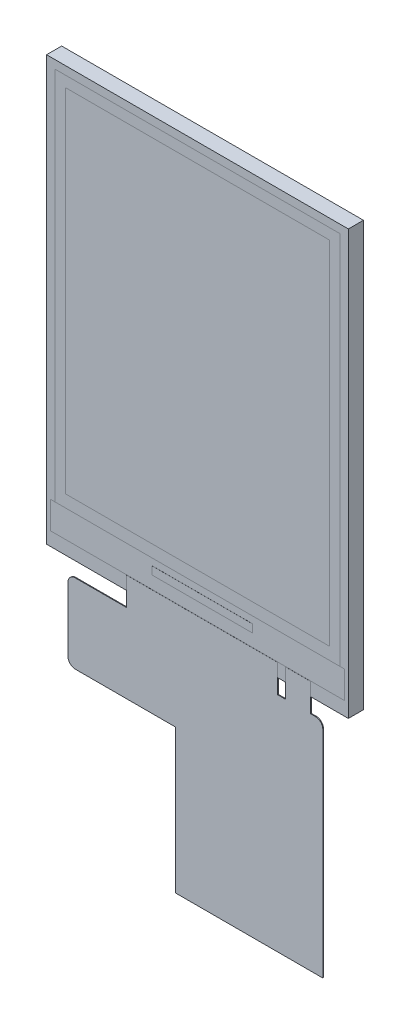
SolidWorks part; units mm, degrees
ref_plane "Front Plane" through (0, 0, 0) normal (0, 0, 1) x (1, 0, 0)
ref_plane "Top Plane" through (0, 0, 0) normal (0, 1, 0) x (1, 0, 0)
ref_plane "Right Plane" through (0, 0, 0) normal (1, 0, 0) x (0, 0, -1)
sketch "Sketch1" plane through (0, 0, 0) normal (0, 0, 1) x (1, 0, 0)
  line L1 (-21, 29.5) -> (21, 29.5)
  line L2 (-21, 29.5) -> (-21, -29.5)
  line L3 (-21, -29.5) -> (21, -29.5)
  line L4 (21, 29.5) -> (21, -29.5)
  line L5 (-19.86, 28.35) -> (19.86, 28.35)
  line L6 (-19.86, 28.35) -> (-19.86, -23.81)
  line L7 (-19.86, -23.81) -> (19.86, -23.81)
  line L8 (19.86, 28.35) -> (19.86, -23.81)
  line L9 (-20.43, -23.81) -> (20.43, -23.81)
  line L10 (-20.43, -23.81) -> (-20.43, -27.61)
  line L11 (-20.43, -27.61) -> (20.43, -27.61)
  line L12 (20.43, -23.81) -> (20.43, -27.61)
  line L13 (-18.36, 26.85) -> (18.36, 26.85)
  line L14 (-18.36, 26.85) -> (-18.36, -22.11)
  line L15 (-18.36, -22.11) -> (18.36, -22.11)
  line L16 (18.36, 26.85) -> (18.36, -22.11)
  point P8 (0, 29.5)
  point P10 (-21, 0)
  dimension "D1" = 42
  dimension "D2" = 59
  dimension "D3" = 1.15
  dimension "D4" = 1.14
  dimension "D5" = 52.16
  dimension "D6" = 39.72
  dimension "D7" = 55.96
  dimension "D8" = 36.72
  dimension "D9" = 48.96
  dimension "D10" = 2.65
  dimension "D11" = 2.64
  dimension "D12" = 0.57
  dimension "D13" = 0.57
sketch "Sketch2" plane through (0, 0, 0) normal (0, 0, 1) x (1, 0, 0)
  line L1 (-9.8446, -27.65) -> (11.1554, -27.65)
  line L2 (-18, -32.55) -> (-18, -41.55)
  line L3 (-17, -42.55) -> (17.45, -42.55)
  line L4 (17.45, -32.55) -> (17.45, -42.55)
  line L5 (21, 29.5) -> (21, -29.5) construction
  line L6 (-3.05, -42.55) -> (17.45, -42.55)
  line L7 (-3.05, -42.55) -> (-3.05, -62.55)
  line L8 (-3.05, -62.55) -> (17.45, -62.55)
  line L9 (17.45, -42.55) -> (17.45, -62.55)
  line L10 (-17, -31.55) -> (-9.8446, -31.55)
  line L11 (-9.8446, -31.55) -> (-9.8446, -27.65)
  line L12 (15.75, -27.65) -> (15.75, -31.55)
  line L13 (15.75, -31.55) -> (16.45, -31.55)
  line L14 (11.1554, -27.65) -> (11.1554, -31.55)
  line L15 (11.1554, -31.55) -> (12.25, -31.55)
  line L16 (12.25, -31.55) -> (12.25, -27.65)
  line L17 (12.25, -27.65) -> (15.75, -27.65)
  arc A0 (-18, -41.55) -> (-17, -42.55) centre (-17, -41.55) ccw
  arc A1 (17.45, -32.55) -> (16.45, -31.55) centre (16.45, -32.55) ccw
  arc A2 (-17, -31.55) -> (-18, -32.55) centre (-17, -32.55) ccw
extrude "Boss-Extrude1" add sketch "Sketch1" along normal blind 2.1 contours L2 L3 L4 L1
extrude "Boss-Extrude3" add sketch "Sketch2" along normal blind 0.1 from offset 2.01 separate body contours L17 L16 L15 L14 L1 L11 L10 L2 L3 L4 L13 L12 | L9 L3 L7 L8
sketch "Sketch4" plane through (0, 0, 2.01) normal (0, 0, -1) x (-1, 0, 0)
  line L0 (3.05, -62.55) -> (-17.45, -62.55) construction
  line L1 (-17.125, -59.05) -> (-16.775, -59.05)
  line L2 (-17.125, -59.05) -> (-17.125, -62.55)
  line L3 (-17.125, -62.55) -> (-16.775, -62.55)
  line L4 (-16.775, -59.05) -> (-16.775, -62.55)
  line L6 (-16.625, -59.05) -> (-16.625, -62.55)
  line L7 (-16.625, -59.05) -> (-16.275, -59.05)
  line L8 (-16.275, -59.05) -> (-16.275, -62.55)
  line L9 (-16.625, -62.55) -> (-16.275, -62.55)
  line L10 (-16.125, -59.05) -> (-16.125, -62.55)
  line L11 (-16.125, -59.05) -> (-15.775, -59.05)
  line L12 (-15.775, -59.05) -> (-15.775, -62.55)
  line L13 (-16.125, -62.55) -> (-15.775, -62.55)
  line L14 (-15.625, -59.05) -> (-15.625, -62.55)
  line L15 (-15.625, -59.05) -> (-15.275, -59.05)
  line L16 (-15.275, -59.05) -> (-15.275, -62.55)
  line L17 (-15.625, -62.55) -> (-15.275, -62.55)
  line L18 (-15.125, -59.05) -> (-15.125, -62.55)
  line L19 (-15.125, -59.05) -> (-14.775, -59.05)
  line L20 (-14.775, -59.05) -> (-14.775, -62.55)
  line L21 (-15.125, -62.55) -> (-14.775, -62.55)
  line L22 (-14.625, -59.05) -> (-14.625, -62.55)
  line L23 (-14.625, -59.05) -> (-14.275, -59.05)
  line L24 (-14.275, -59.05) -> (-14.275, -62.55)
  line L25 (-14.625, -62.55) -> (-14.275, -62.55)
  line L26 (-14.125, -59.05) -> (-14.125, -62.55)
  line L27 (-14.125, -59.05) -> (-13.775, -59.05)
  line L28 (-13.775, -59.05) -> (-13.775, -62.55)
  line L29 (-14.125, -62.55) -> (-13.775, -62.55)
  line L30 (-13.625, -59.05) -> (-13.625, -62.55)
  line L31 (-13.625, -59.05) -> (-13.275, -59.05)
  line L32 (-13.275, -59.05) -> (-13.275, -62.55)
  line L33 (-13.625, -62.55) -> (-13.275, -62.55)
  line L34 (-13.125, -59.05) -> (-13.125, -62.55)
  line L35 (-13.125, -59.05) -> (-12.775, -59.05)
  line L36 (-12.775, -59.05) -> (-12.775, -62.55)
  line L37 (-13.125, -62.55) -> (-12.775, -62.55)
  line L38 (-12.625, -59.05) -> (-12.625, -62.55)
  line L39 (-12.625, -59.05) -> (-12.275, -59.05)
  line L40 (-12.275, -59.05) -> (-12.275, -62.55)
  line L41 (-12.625, -62.55) -> (-12.275, -62.55)
  line L42 (-12.125, -59.05) -> (-12.125, -62.55)
  line L43 (-12.125, -59.05) -> (-11.775, -59.05)
  line L44 (-11.775, -59.05) -> (-11.775, -62.55)
  line L45 (-12.125, -62.55) -> (-11.775, -62.55)
  line L46 (-11.625, -59.05) -> (-11.625, -62.55)
  line L47 (-11.625, -59.05) -> (-11.275, -59.05)
  line L48 (-11.275, -59.05) -> (-11.275, -62.55)
  line L49 (-11.625, -62.55) -> (-11.275, -62.55)
  line L50 (-11.125, -59.05) -> (-11.125, -62.55)
  line L51 (-11.125, -59.05) -> (-10.775, -59.05)
  line L52 (-10.775, -59.05) -> (-10.775, -62.55)
  line L53 (-11.125, -62.55) -> (-10.775, -62.55)
  line L54 (-10.625, -59.05) -> (-10.625, -62.55)
  line L55 (-10.625, -59.05) -> (-10.275, -59.05)
  line L56 (-10.275, -59.05) -> (-10.275, -62.55)
  line L57 (-10.625, -62.55) -> (-10.275, -62.55)
  line L58 (-10.125, -59.05) -> (-10.125, -62.55)
  line L59 (-10.125, -59.05) -> (-9.775, -59.05)
  line L60 (-9.775, -59.05) -> (-9.775, -62.55)
  line L61 (-10.125, -62.55) -> (-9.775, -62.55)
  line L62 (-9.625, -59.05) -> (-9.625, -62.55)
  line L63 (-9.625, -59.05) -> (-9.275, -59.05)
  line L64 (-9.275, -59.05) -> (-9.275, -62.55)
  line L65 (-9.625, -62.55) -> (-9.275, -62.55)
  line L66 (-9.125, -59.05) -> (-9.125, -62.55)
  line L67 (-9.125, -59.05) -> (-8.775, -59.05)
  line L68 (-8.775, -59.05) -> (-8.775, -62.55)
  line L69 (-9.125, -62.55) -> (-8.775, -62.55)
  line L70 (-8.625, -59.05) -> (-8.625, -62.55)
  line L71 (-8.625, -59.05) -> (-8.275, -59.05)
  line L72 (-8.275, -59.05) -> (-8.275, -62.55)
  line L73 (-8.625, -62.55) -> (-8.275, -62.55)
  line L74 (-8.125, -59.05) -> (-8.125, -62.55)
  line L75 (-8.125, -59.05) -> (-7.775, -59.05)
  line L76 (-7.775, -59.05) -> (-7.775, -62.55)
  line L77 (-8.125, -62.55) -> (-7.775, -62.55)
  line L78 (-7.625, -59.05) -> (-7.625, -62.55)
  line L79 (-7.625, -59.05) -> (-7.275, -59.05)
  line L80 (-7.275, -59.05) -> (-7.275, -62.55)
  line L81 (-7.625, -62.55) -> (-7.275, -62.55)
  line L82 (-7.125, -59.05) -> (-7.125, -62.55)
  line L83 (-7.125, -59.05) -> (-6.775, -59.05)
  line L84 (-6.775, -59.05) -> (-6.775, -62.55)
  line L85 (-7.125, -62.55) -> (-6.775, -62.55)
  line L86 (-6.625, -59.05) -> (-6.625, -62.55)
  line L87 (-6.625, -59.05) -> (-6.275, -59.05)
  line L88 (-6.275, -59.05) -> (-6.275, -62.55)
  line L89 (-6.625, -62.55) -> (-6.275, -62.55)
  line L90 (-6.125, -59.05) -> (-6.125, -62.55)
  line L91 (-6.125, -59.05) -> (-5.775, -59.05)
  line L92 (-5.775, -59.05) -> (-5.775, -62.55)
  line L93 (-6.125, -62.55) -> (-5.775, -62.55)
  line L94 (-5.625, -59.05) -> (-5.625, -62.55)
  line L95 (-5.625, -59.05) -> (-5.275, -59.05)
  line L96 (-5.275, -59.05) -> (-5.275, -62.55)
  line L97 (-5.625, -62.55) -> (-5.275, -62.55)
  line L98 (-5.125, -59.05) -> (-5.125, -62.55)
  line L99 (-5.125, -59.05) -> (-4.775, -59.05)
  line L100 (-4.775, -59.05) -> (-4.775, -62.55)
  line L101 (-5.125, -62.55) -> (-4.775, -62.55)
  line L102 (-4.625, -59.05) -> (-4.625, -62.55)
  line L103 (-4.625, -59.05) -> (-4.275, -59.05)
  line L104 (-4.275, -59.05) -> (-4.275, -62.55)
  line L105 (-4.625, -62.55) -> (-4.275, -62.55)
  line L106 (-4.125, -59.05) -> (-4.125, -62.55)
  line L107 (-4.125, -59.05) -> (-3.775, -59.05)
  line L108 (-3.775, -59.05) -> (-3.775, -62.55)
  line L109 (-4.125, -62.55) -> (-3.775, -62.55)
  line L110 (-3.625, -59.05) -> (-3.625, -62.55)
  line L111 (-3.625, -59.05) -> (-3.275, -59.05)
  line L112 (-3.275, -59.05) -> (-3.275, -62.55)
  line L113 (-3.625, -62.55) -> (-3.275, -62.55)
  line L114 (-3.125, -59.05) -> (-3.125, -62.55)
  line L115 (-3.125, -59.05) -> (-2.775, -59.05)
  line L116 (-2.775, -59.05) -> (-2.775, -62.55)
  line L117 (-3.125, -62.55) -> (-2.775, -62.55)
  line L118 (-2.625, -59.05) -> (-2.625, -62.55)
  line L119 (-2.625, -59.05) -> (-2.275, -59.05)
  line L120 (-2.275, -59.05) -> (-2.275, -62.55)
  line L121 (-2.625, -62.55) -> (-2.275, -62.55)
  line L122 (-2.125, -59.05) -> (-2.125, -62.55)
  line L123 (-2.125, -59.05) -> (-1.775, -59.05)
  line L124 (-1.775, -59.05) -> (-1.775, -62.55)
  line L125 (-2.125, -62.55) -> (-1.775, -62.55)
  line L126 (-1.625, -59.05) -> (-1.625, -62.55)
  line L127 (-1.625, -59.05) -> (-1.275, -59.05)
  line L128 (-1.275, -59.05) -> (-1.275, -62.55)
  line L129 (-1.625, -62.55) -> (-1.275, -62.55)
  line L130 (-1.125, -59.05) -> (-1.125, -62.55)
  line L131 (-1.125, -59.05) -> (-0.775, -59.05)
  line L132 (-0.775, -59.05) -> (-0.775, -62.55)
  line L133 (-1.125, -62.55) -> (-0.775, -62.55)
  line L134 (-0.625, -59.05) -> (-0.625, -62.55)
  line L135 (-0.625, -59.05) -> (-0.275, -59.05)
  line L136 (-0.275, -59.05) -> (-0.275, -62.55)
  line L137 (-0.625, -62.55) -> (-0.275, -62.55)
  line L138 (-0.125, -59.05) -> (-0.125, -62.55)
  line L139 (-0.125, -59.05) -> (0.225, -59.05)
  line L140 (0.225, -59.05) -> (0.225, -62.55)
  line L141 (-0.125, -62.55) -> (0.225, -62.55)
  line L142 (0.375, -59.05) -> (0.375, -62.55)
  line L143 (0.375, -59.05) -> (0.725, -59.05)
  line L144 (0.725, -59.05) -> (0.725, -62.55)
  line L145 (0.375, -62.55) -> (0.725, -62.55)
  line L146 (0.875, -59.05) -> (0.875, -62.55)
  line L147 (0.875, -59.05) -> (1.225, -59.05)
  line L148 (1.225, -59.05) -> (1.225, -62.55)
  line L149 (0.875, -62.55) -> (1.225, -62.55)
  line L150 (1.375, -59.05) -> (1.375, -62.55)
  line L151 (1.375, -59.05) -> (1.725, -59.05)
  line L152 (1.725, -59.05) -> (1.725, -62.55)
  line L153 (1.375, -62.55) -> (1.725, -62.55)
  line L154 (1.875, -59.05) -> (1.875, -62.55)
  line L155 (1.875, -59.05) -> (2.225, -59.05)
  line L156 (2.225, -59.05) -> (2.225, -62.55)
  line L157 (1.875, -62.55) -> (2.225, -62.55)
  line L158 (2.375, -59.05) -> (2.375, -62.55)
  line L159 (2.375, -59.05) -> (2.725, -59.05)
  line L160 (2.725, -59.05) -> (2.725, -62.55)
  line L161 (2.375, -62.55) -> (2.725, -62.55)
  line L164 (-16.95, -59.05) -> (-16.95, -62.8223) construction
  line L165 (-17.45, -32.55) -> (-17.45, -62.55) construction
  dimension "D1" = 3.5
  dimension "D2" = 0.5
  dimension "D3" = 0.35
  dimension "D5" = 0.5
  dimension "D4" = 40
extrude "Boss-Extrude4" add sketch "Sketch4" along normal blind 0.1 separate body
sketch "Sketch5" plane through (0, 0, 2.1) normal (0, 0, 1) x (1, 0, 0)
  line L0 (11.1554, -27.65) -> (11.1554, -31.55) construction
  line L1 (-6.3446, -24.7568) -> (7.6554, -24.7568)
  line L2 (-6.3446, -24.7568) -> (-6.3446, -25.86)
  line L3 (-6.3446, -25.86) -> (7.6554, -25.86)
  line L4 (7.6554, -24.7568) -> (7.6554, -25.86)
  line L5 (-9.8446, -31.55) -> (-9.8446, -27.65) construction
  line L8 (-20.43, -27.61) -> (20.43, -27.61) construction
  line L9 (-19.86, -23.81) -> (19.86, -23.81) construction
  dimension "D1" = 3.5
  dimension "D2" = 3.5
  dimension "D4" = 1.75
  dimension "D5" = 0.9468
extrude "Boss-Extrude5" add sketch "Sketch5" along normal blind 0.01
equation "\"D12@Sketch2\"=59/2-(3-1.15)"
